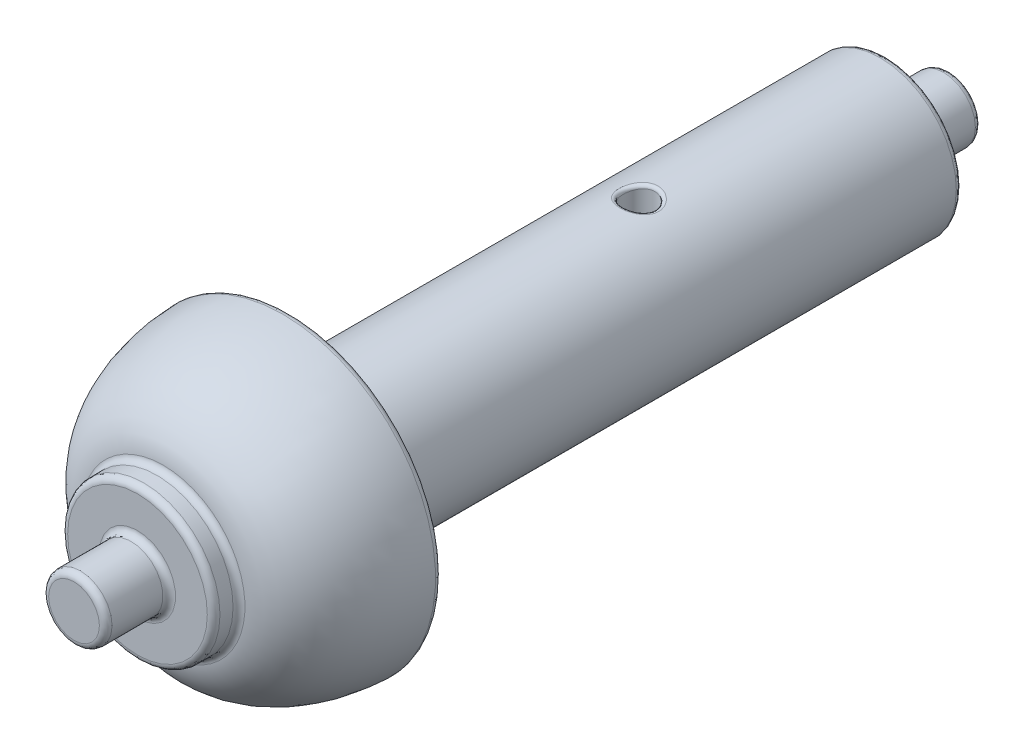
SolidWorks part; units mm, degrees
ref_plane "Спереди" through (0, 0, 0) normal (0, 0, 1) x (1, 0, 0)
ref_plane "Сверху" through (0, 0, 0) normal (0, 1, 0) x (1, 0, 0)
ref_plane "Справа" through (0, 0, 0) normal (1, 0, 0) x (0, 0, -1)
sketch "Эскиз1" plane through (0, 0, 0) normal (1, 0, 0) x (0, 0, -1)
  line L0 (-35, 0) -> (35, 0)
  line L1 (35, 0) -> (35, 2.5)
  line L2 (35, 2.5) -> (30, 2.5)
  line L3 (30, 2.5) -> (30, 6)
  line L4 (30, 6) -> (-17, 6)
  line L5 (-17, 6) -> (-17, 12)
  line L6 (-35, 0) -> (-35, 2.5)
  line L7 (-35, 2.5) -> (-30, 2.5)
  line L8 (-30, 2.5) -> (-30, 6)
  line L9 (-30, 6) -> (-28, 6)
  line L10 (-28, 12) -> (-28, 0) construction
  ellipse E0 centre (-17, 6) end of major axis (-28, 6) minor radius 6 (-17, 12) -> (-28, 6) ccw
  dimension "D1" = 60
  dimension "D2" = 5
  dimension "D3" = 2.5
  dimension "D4" = 6
  dimension "D5" = 47
  dimension "D6" = 12
  dimension "D7" = 11
revolve "Повернуть1" add sketch "Эскиз1" angle 360 about L0
sketch "Эскиз2" plane through (0, 0, 0) normal (0, 1, 0) x (1, 0, 0)
  line L0 (6, 30) -> (-6, 30) construction
  circle A0 centre (0, 10) radius 1.25
  dimension "D1" = 2.5
  dimension "D2" = 20
extrude "Вырез-Вытянуть1" cut sketch "Эскиз2" against normal mid plane 20
fillet "Скругление1" radius 0.5 9 edges at (2.5, 0, 30) (2.5, 0, 35) (2.5, 0, -35) (2.5, 0, -30) (6, 0, 28) (6, 0, 30) (12, 0, 17) (6, 0, 17) (6, 0, -30)
fillet "Скругление2" radius 0.25 2 edges at (-0.2574, -5.9945, -11.2232) (0.2574, 5.9945, -11.2232)
